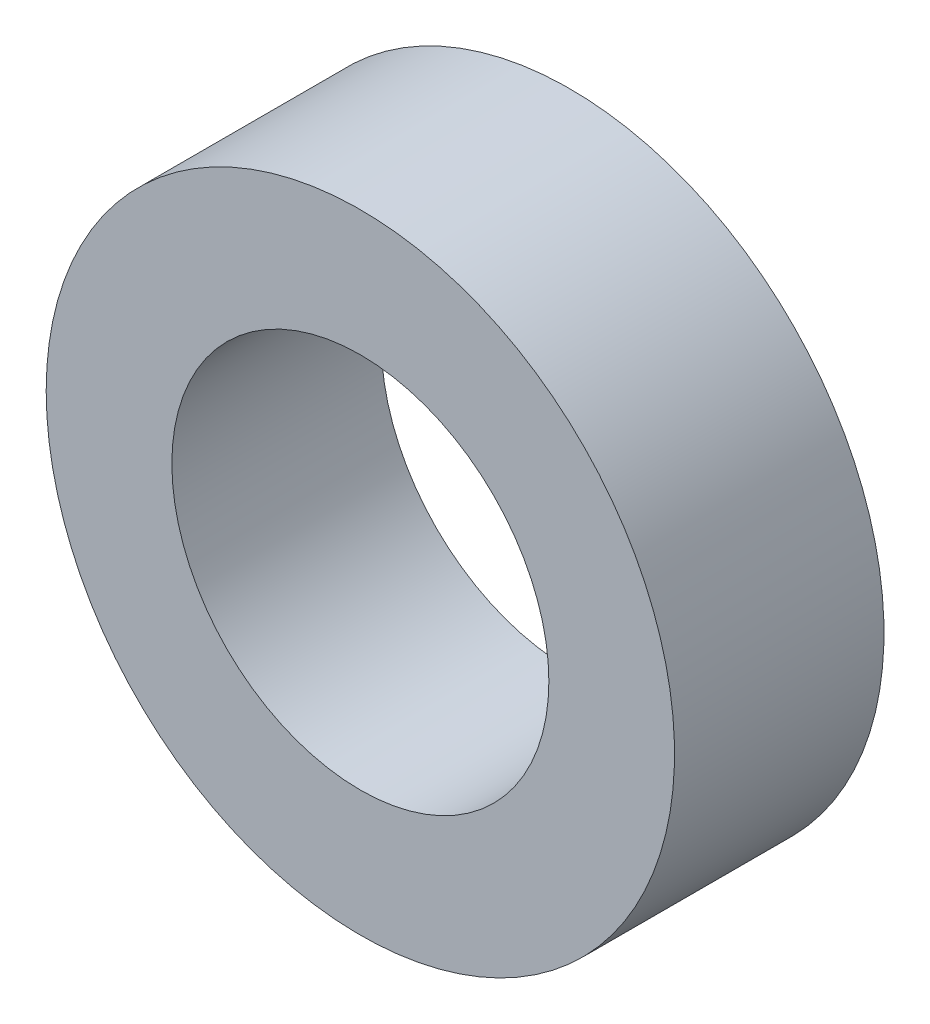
SolidWorks part; units mm, degrees
ref_plane "Front" through (0, 0, 0) normal (0, 0, 1) x (1, 0, 0)
ref_plane "Top" through (0, 0, 0) normal (0, 1, 0) x (1, 0, 0)
ref_plane "Right" through (0, 0, 0) normal (1, 0, 0) x (0, 0, -1)
sketch "Logo3_Revol_Axis" plane through (0, 0, 0) normal (0, 1, 0) x (1, 0, 0)
  line L0 (0, -30.1653) -> (0, 30.1653) construction
sketch "Logo3_bib1" plane through (0, 0, 0) normal (0, -1, 0) x (-1, 0, 0)
  line L0 (9.525, 0) -> (5.715, 0)
  line L1 (5.715, 0) -> (5.715, -6.35)
  line L2 (5.715, -6.35) -> (9.525, -6.35)
  line L3 (7.62, 0) -> (7.62, -6.35) construction
  line L4 (9.525, -6.35) -> (9.525, 0)
  line L5 (9.525, -3.175) -> (5.715, -3.175) construction
  line L10 (0, 38.9764) -> (0, -41.3764) construction
  point P11 (5.715, 0)
  point P15 (5.715, -6.35)
revolve "Revolve1" add sketch "Logo3_bib1" angle 360 about L10
equation "\"D2@Logo3_bib1\"=\"logo3_l1@Logo3_bib1\"/2"
equation "\"D3@Logo3_bib1\"=(\"logo3_d1@Logo3_bib1\"-\"logo3_d_in@Logo3_bib1\")/4"
